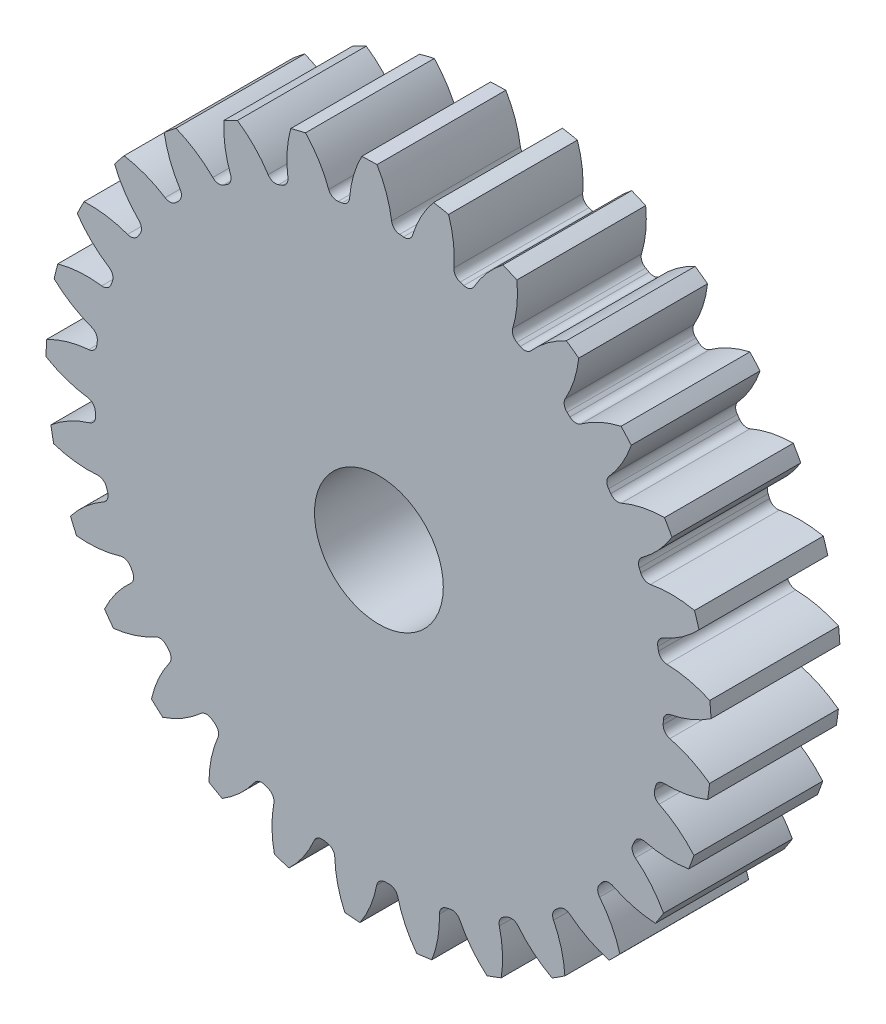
SolidWorks part; units mm, degrees
ref_plane "Front" through (0, 0, 0) normal (0, 0, 1) x (1, 0, 0)
ref_plane "Top" through (0, 0, 0) normal (0, 1, 0) x (1, 0, 0)
ref_plane "Right" through (0, 0, 0) normal (1, 0, 0) x (0, 0, -1)
sketch "Sketch3" plane through (0, 0, 0) normal (0, 0, 1) x (1, 0, 0)
  circle A0 centre (0, 0) radius 262.4667
  dimension "od" = 524.9333
extrude "gearBody" add sketch "Sketch3" along normal blind 101.6
sketch "Sketch2" plane through (0, 0, 0) normal (0, 0, 1) x (1, 0, 0)
  line L0 (0, 0) -> (213.1629, 88.295) construction
  line L1 (261.305, -29.4156) -> (0, 0) construction
  line L2 (0, 0) -> (36.3143, 0) construction
  line L3 (245.4341, 6.979) -> (244.7569, -19.5105) construction
  line L5 (245.0955, -6.2657) -> (0, 0) construction
  line L7 (0, 0) -> (230.7259, 0) construction
  arc A0 (230.7114, 2.5875) -> (230.2778, -14.3725) centre (0, 0) ccw construction
  arc A1 (261.9963, 15.707) -> (260.8515, -29.0733) centre (0, 0) ccw construction
  arc A2 (245.4341, 6.979) -> (244.7569, -19.5105) centre (0, 0) ccw construction
  arc A3 (224.2493, -7.2576) -> (224.3272, -4.21) centre (0, 0) ccw
  arc A4 (261.305, -29.4156) -> (229.4751, -14.169) centre (208.373, -99.0713) ccw
  arc A5 (261.305, -29.4156) -> (262.4667, 16.0257) centre (0, 0) ccw
  arc A6 (262.4667, 16.0257) -> (229.8994, 2.4253) centre (213.1629, 88.295) cw
  arc A7 (224.3272, -4.21) -> (229.8994, 2.4253) centre (231.2178, -4.3393) cw
  arc A8 (229.4751, -14.169) -> (224.2493, -7.2576) centre (231.1375, -7.4806) cw
  point P6 (262.4667, 16.0257)
  point P22 (261.305, -29.4156)
  dimension "baseDia" = 461.4517
  dimension "od" = 524.9333
  dimension "pd" = 491.0667
  dimension "rd" = 448.7333
  dimension "rFillet" = 6.8919
  dimension "pointX" = 262.4667
  dimension "pointY" = 16.0257
  dimension "CTT" = 26.4896
  dimension "flankCenterAngle" = 22.5
extrude "toothCut" cut sketch "Sketch2" along normal through all
pattern_circular "CirPattern1" count 29 over 360 about axis through (0, 0, 0) along (0, 0, 1) of "toothCut"
sketch "hub1Dia" plane through (0, 0, 0) normal (0, 0, -1) x (-1, 0, 0)
  circle A0 centre (0, 0) radius 12.7
  dimension "hub1Dia" = 25.4
sketch "hub2Dia" plane through (0, 0, 101.6) normal (0, 0, 1) x (1, 0, 0)
  circle A0 centre (0, 0) radius 12.7
  dimension "hub2dia" = 25.4
sketch "boreDia" plane through (0, 0, 0) normal (0, 0, 1) x (1, 0, 0)
  circle A0 centre (0, 0) radius 50.8
  dimension "boreDia" = 101.6
extrude "bore" cut sketch "boreDia" against normal mid plane 25400
